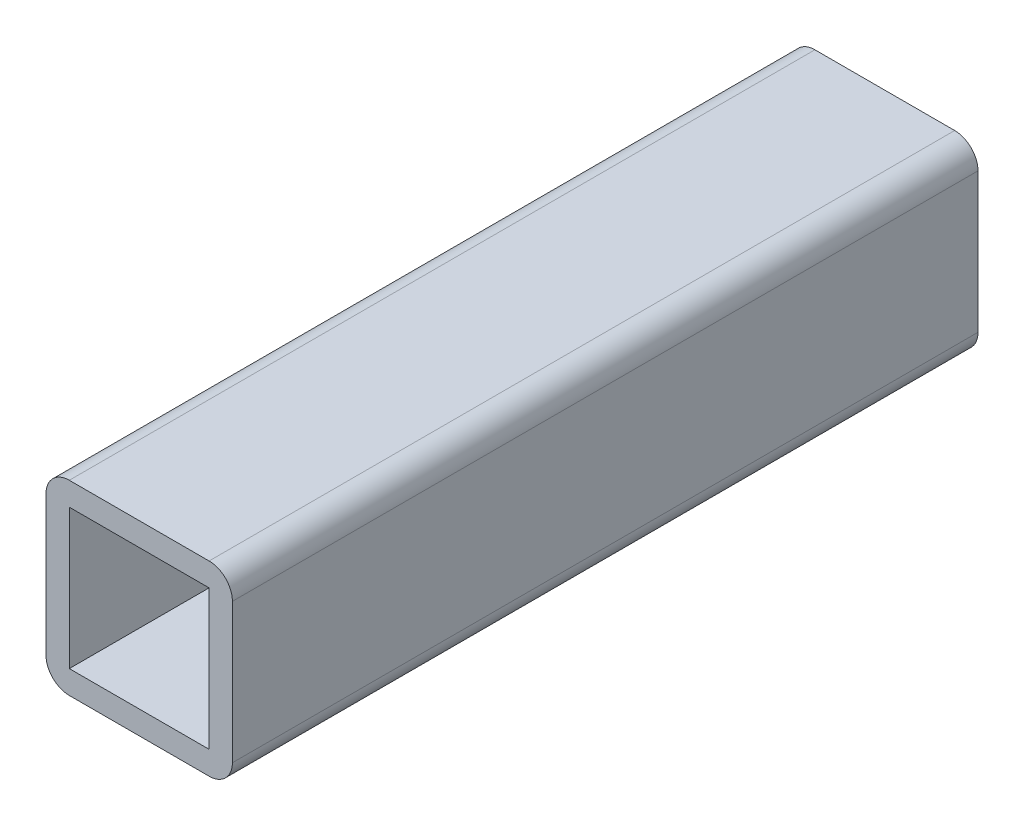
SolidWorks part; units mm, degrees
ref_plane "Front Plane" through (0, 0, 0) normal (0, 0, 1) x (1, 0, 0)
ref_plane "Top Plane" through (0, 0, 0) normal (0, 1, 0) x (1, 0, 0)
ref_plane "Right Plane" through (0, 0, 0) normal (1, 0, 0) x (0, 0, -1)
sketch "Sketch1" plane through (0, 0, 0) normal (0, 0, 1) x (1, 0, 0)
  line L0 (-19.05, -19.05) -> (-19.05, 19.05)
  line L1 (-19.05, -25.4) -> (19.05, -25.4)
  line L2 (-25.4, -19.05) -> (-25.4, 19.05)
  line L3 (-19.05, 25.4) -> (19.05, 25.4)
  line L4 (25.4, -19.05) -> (25.4, 19.05)
  line L5 (-19.05, 19.05) -> (19.05, 19.05)
  line L6 (19.05, -19.05) -> (19.05, 19.05)
  line L7 (-19.05, -19.05) -> (19.05, -19.05)
  arc A0 (-19.05, -25.4) -> (-25.4, -19.05) centre (-19.05, -19.05) cw
  arc A1 (19.05, -25.4) -> (25.4, -19.05) centre (19.05, -19.05) ccw
  arc A2 (19.05, 25.4) -> (25.4, 19.05) centre (19.05, 19.05) cw
  arc A3 (-25.4, 19.05) -> (-19.05, 25.4) centre (-19.05, 19.05) cw
  arc A4 (-19.05, 19.05) -> (-19.05, 19.05) centre (-19.05, 19.05) cw
  arc A5 (19.05, 19.05) -> (19.05, 19.05) centre (19.05, 19.05) cw
  arc A6 (19.05, -19.05) -> (19.05, -19.05) centre (19.05, -19.05) ccw
  arc A7 (-19.05, -19.05) -> (-19.05, -19.05) centre (-19.05, -19.05) cw
  dimension "D5" = 6.35
  dimension "D1" = 50.8
  dimension "D2" = 50.8
  dimension "D3" = 25.4
  dimension "D4" = 25.4
  dimension "D6" = 6.35
extrude "Boss-Extrude1" add sketch "Sketch1" against normal blind 203.2
